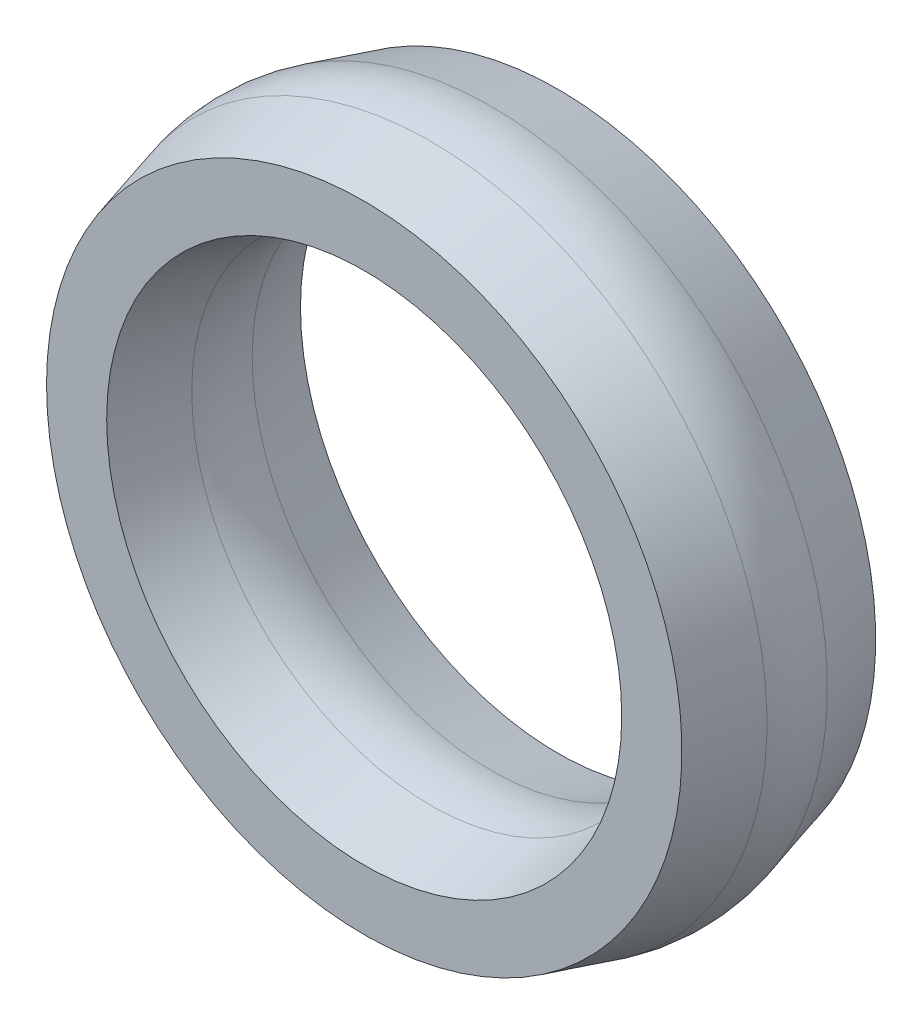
SolidWorks part; units mm, degrees
ref_plane "Front" through (0, 0, 0) normal (0, 0, 1) x (1, 0, 0)
ref_plane "Top" through (0, 0, 0) normal (0, 1, 0) x (1, 0, 0)
ref_plane "Right" through (0, 0, 0) normal (1, 0, 0) x (0, 0, -1)
sketch "Sketch1" plane through (0, 0, 0) normal (0, 1, 0) x (-1, 0, 0)
  line L0 (0, -7.25) -> (0, 7.5642) construction
  line L1 (0, -7.25) -> (-28.4986, -7.25) construction
  line L2 (-23.7675, 0) -> (-19.2675, 0)
  line L3 (-19.2675, 0) -> (-17.8911, -4.9896)
  line L4 (-21.5175, 0) -> (-21.5175, -7.25) construction
  line L5 (-19.2675, -14.5) -> (-17.8911, -9.5104)
  line L6 (-23.7675, -14.5) -> (-19.2675, -14.5)
  line L7 (-23.7675, -14.5) -> (-25.1439, -9.5104)
  line L8 (-23.7675, 0) -> (-25.1439, -4.9896)
  arc A0 (-17.8911, -9.5104) -> (-17.8911, -4.9896) centre (-26.085, -7.25) ccw
  arc A1 (-25.1439, -9.5104) -> (-25.1439, -4.9896) centre (-16.95, -7.25) cw
  point P12 (-17.2675, -7.25)
  point P17 (-21.5175, -14.5)
  dimension "D4" = 8.5
  dimension "s1" = 4.5
  dimension "h" = 14.5
  dimension "s" = 8.5
  dimension "D" = 50.9
revolve "Body" add sketch "Sketch1" angle 360 about L0
sketch "Sketch4" plane through (0, 0, 0) normal (0, 1, 0) x (-1, 0, 0)
  line L0 (-19.2675, 0) -> (-19.2675, -14.5)
  line L1 (-19.2675, 0) -> (-25.45, 0)
  line L2 (-25.45, 0) -> (-25.45, -14.5)
  line L3 (-25.45, -14.5) -> (-19.2675, -14.5)
  line L4 (0, 0) -> (0, 12.1247) construction
  arc A0 (-25.1439, -4.9896) -> (-25.1439, -9.5104) centre (-16.95, -7.25) ccw construction
revolve "Cut-Revolve1" [suppressed] cut sketch "Sketch4" angle 360 about L4
sketch "Sketch3" plane through (0, 0, 0) normal (0, 1, 0) x (1, 0, 0)
  line L0 (-16.95, 14.5) -> (-16.95, 0)
  line L1 (-16.95, 0) -> (-21.45, 0)
  line L2 (-21.45, 0) -> (-23.2, 4.35)
  line L3 (-23.2, 4.35) -> (-25.45, 5.8)
  line L4 (-25.45, 5.8) -> (-25.45, 8.7)
  line L5 (-25.45, 7.25) -> (-16.95, 7.25) construction
  line L6 (-23.2, 10.15) -> (-25.45, 8.7)
  line L7 (-21.45, 14.5) -> (-23.2, 10.15)
  line L8 (-16.95, 14.5) -> (-21.45, 14.5)
  line L10 (0, -15.5494) -> (0, 19.4432) construction
  dimension "D1" = 14.5
  dimension "s" = 8.5
  dimension "D3" = 2.9
  dimension "s1" = 4.5
  dimension "D5" = 2.25
  dimension "D6" = 5.8
  dimension "D7" = 50.9
revolve "Revolve1" [suppressed] add sketch "Sketch3" angle 360 about L10
fillet "Fillet1" [suppressed] radius 2.9
fillet "Fillet2" [suppressed] radius 2.9
equation "\"D4@Sketch1\" = \"s@Sketch1\""
equation "\"D3@Sketch3\" = \"D1@Sketch3\" / 5"
equation "\"D5@Sketch3\" = \"s1@Sketch3\" / 2"
equation "\"D6@Sketch3\" = \"D3@Sketch3\" * 2"
equation "\"D1@Fillet2\" = \"D3@Sketch3\""
equation "\"D1@Fillet1\" = \"D3@Sketch3\""
equation "\"D7@Sketch3\" = \"D@Sketch1\""
equation "\"D1@Sketch3\" = \"h@Sketch1\""
